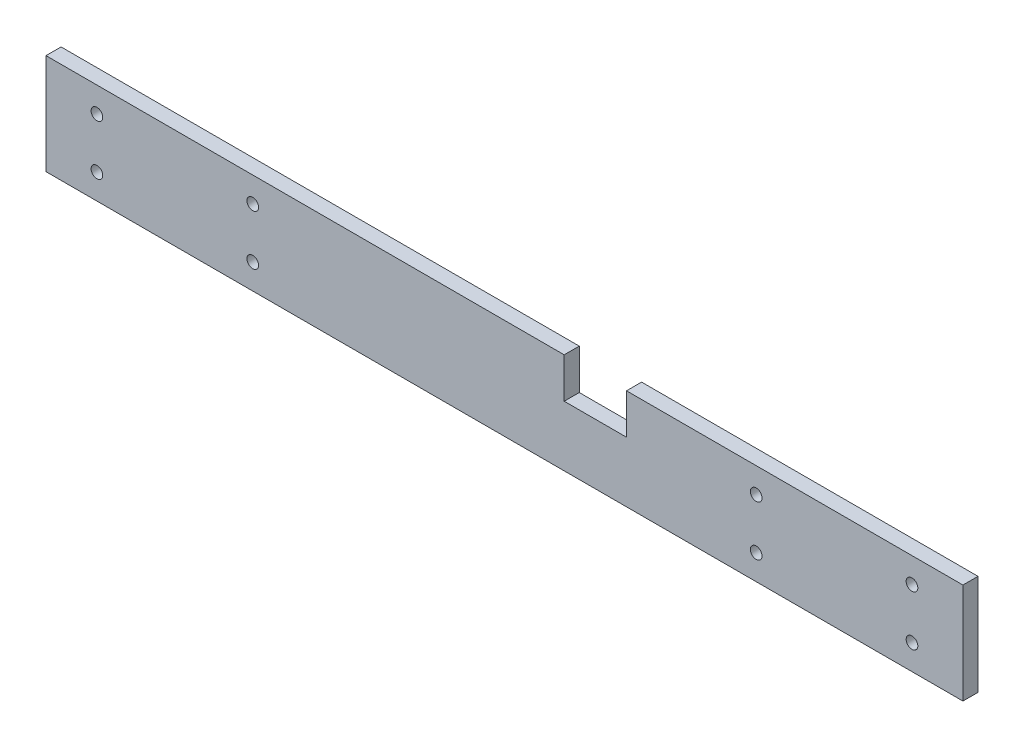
SolidWorks part; units mm, degrees
ref_plane "Front Plane" through (0, 0, 0) normal (0, 0, 1) x (1, 0, 0)
ref_plane "Top Plane" through (0, 0, 0) normal (0, 1, 0) x (1, 0, 0)
ref_plane "Right Plane" through (0, 0, 0) normal (1, 0, 0) x (0, 0, -1)
sketch "Sketch1" plane through (0, 0, 0) normal (0, 0, 1) x (1, 0, 0)
  line L1 (-144.8054, -15.875) -> (144.8054, -15.875)
  line L2 (-144.8054, -15.875) -> (-144.8054, 15.875)
  line L3 (-144.8054, 15.875) -> (144.8054, 15.875)
  line L4 (144.8054, -15.875) -> (144.8054, 15.875)
  line L5 (0, 15.875) -> (0, -15.875) construction
  line L6 (-144.8054, 0) -> (144.8054, 0) construction
  point P0 (0, 0)
  dimension "D1" = 289.6108
  dimension "D2" = 31.75
base flange "Base-Flange1" sketch "Sketch1" thickness 4.7625 reverse thickness direction no parameters "D1"=0.7366
sketch "Sketch2" plane through (0, 0, -4.7625) normal (0, 0, -1) x (-1, 0, 0)
  line L0 (82.0483, 9.779) -> (76.9683, 9.779) construction
  line L1 (76.9683, -9.779) -> (82.0483, -9.779) construction
  line L2 (0, 0) -> (0, 15.875) construction
  line L3 (126.1808, 6.096) -> (131.2609, 6.096)
  line L4 (131.2609, 9.779) -> (126.1809, 9.779)
  line L5 (126.1808, 6.096) -> (131.2609, 6.096) construction
  line L6 (131.2609, 9.779) -> (126.1809, 9.779) construction
  line L7 (-144.8054, 15.875) -> (144.8054, 15.875) construction
  line L8 (126.1808, -9.779) -> (131.2609, -9.779)
  line L9 (131.2609, -6.096) -> (126.1809, -6.096)
  line L10 (126.1808, -9.779) -> (131.2609, -9.779) construction
  line L11 (131.2609, -6.096) -> (126.1809, -6.096) construction
  circle A0 centre (128.7209, 7.9375) radius 1.8415
  circle A1 centre (128.7209, -7.9375) radius 1.8415
  circle A10 centre (-128.7209, -7.9375) radius 1.8415
  circle A11 centre (-128.7209, 7.9375) radius 1.8415
  circle A12 centre (79.5083, 7.9375) radius 1.8415
  circle A13 centre (79.5083, -7.9375) radius 1.8415
  circle A14 centre (-79.5083, -7.9375) radius 1.8415
  circle A15 centre (-79.5083, 7.9375) radius 1.8415
  arc A18 (126.1809, 9.779) -> (126.1808, 6.096) centre (126.1809, 7.9375) ccw
  arc A19 (126.1809, 9.779) -> (126.1808, 6.096) centre (126.1809, 7.9375) ccw construction
  arc A20 (131.2609, 6.096) -> (131.2609, 9.779) centre (131.2609, 7.9375) ccw
  arc A21 (131.2609, 6.096) -> (131.2609, 9.779) centre (131.2609, 7.9375) ccw construction
  arc A22 (126.1809, -6.096) -> (126.1808, -9.779) centre (126.1809, -7.9375) ccw
  arc A23 (126.1809, -6.096) -> (126.1808, -9.779) centre (126.1809, -7.9375) ccw construction
  arc A24 (131.2609, -9.779) -> (131.2609, -6.096) centre (131.2609, -7.9375) ccw
  arc A25 (131.2609, -9.779) -> (131.2609, -6.096) centre (131.2609, -7.9375) ccw construction
  point P0 (128.7209, 9.779)
  point P1 (122.3702, 7.9375)
  point P10 (128.7209, -6.096)
  point P15 (122.3702, -7.9375)
  point P29 (79.5083, 9.779)
  point P30 (79.5083, -9.779)
  dimension "D1" = 0
  dimension "D2" = 0
extrude "Cut-Extrude1" cut sketch "Sketch2" against normal through all contours A11
sketch "Sketch3" plane through (0, 0, -4.7625) normal (0, 0, -1) x (-1, 0, 0)
  line L0 (-38.5509, 15.875) -> (-38.5509, 3.175)
  line L1 (-144.8054, 15.875) -> (144.8054, 15.875) construction
  line L2 (-38.5509, 3.175) -> (-18.8659, 3.175)
  line L3 (-18.8659, 3.175) -> (-18.8659, 15.875)
  line L4 (-18.8659, 15.875) -> (90.0367, 15.875) construction
  line L5 (-38.5509, 15.875) -> (-38.5509, 17.4625) construction
  line L6 (-18.8659, 15.875) -> (-18.8659, 17.4625) construction
  dimension "D1" = 12.7
extrude "Cut-Extrude2" cut sketch "Sketch3" against normal through all and the other way through all
sketch "Bend-Lines1" [suppressed] plane through (0, 0, 0) normal (0, 1, 0) x (1, 0, 0)
sketch "Bounding-Box1" [suppressed] plane through (0, 0, 0) normal (0, 1, 0) x (1, 0, 0)
sheet metal parameters "Sheet-Metal1" thickness 4.7625 parameters "D1"=0.7366
flat pattern "Flat-Pattern1"
sketch "Bend-Lines2" plane through (0, 0, 0) normal (0, 1, 0) x (1, 0, 0)
sketch3d "Bounding-Box2" [suppressed]
  line L0 (-135.4582, -15.875, 0) -> (135.4582, -15.875, 0) construction
  line L1 (-135.4582, 15.875, 0) -> (135.4582, 15.875, 0) construction
  line L2 (-135.4582, -15.875, 0) -> (-135.4582, 15.875, 0) construction
  line L3 (135.4582, -15.875, 0) -> (135.4582, 15.875, 0) construction
sheet metal parameters "Sheet-Metal2" thickness 4.7625 parameters "D1"=0.7366
flat pattern "Flat-Pattern1"
sketch "Bend-Lines2" plane through (0, 0, 0) normal (0, 1, 0) x (1, 0, 0)
sketch3d "Bounding-Box2" [suppressed]
  line L0 (-144.8054, -15.875, 0) -> (144.8054, -15.875, 0) construction
  line L1 (-144.8054, 15.875, 0) -> (144.8054, 15.875, 0) construction
  line L2 (-144.8054, -15.875, 0) -> (-144.8054, 15.875, 0) construction
  line L3 (144.8054, -15.875, 0) -> (144.8054, 15.875, 0) construction
sheet metal parameters "Sheet-Metal3" thickness 4.7625 parameters "D1"=0.7366
flat pattern "Flat-Pattern1"
sketch "Bend-Lines2" plane through (0, 0, 0) normal (0, 1, 0) x (1, 0, 0)
sketch3d "Bounding-Box2" [suppressed]
  line L0 (-144.8054, -15.875, 0) -> (144.8054, -15.875, 0) construction
  line L1 (-144.8054, 15.875, 0) -> (144.8054, 15.875, 0) construction
  line L2 (-144.8054, -15.875, 0) -> (-144.8054, 15.875, 0) construction
  line L3 (144.8054, -15.875, 0) -> (144.8054, 15.875, 0) construction
